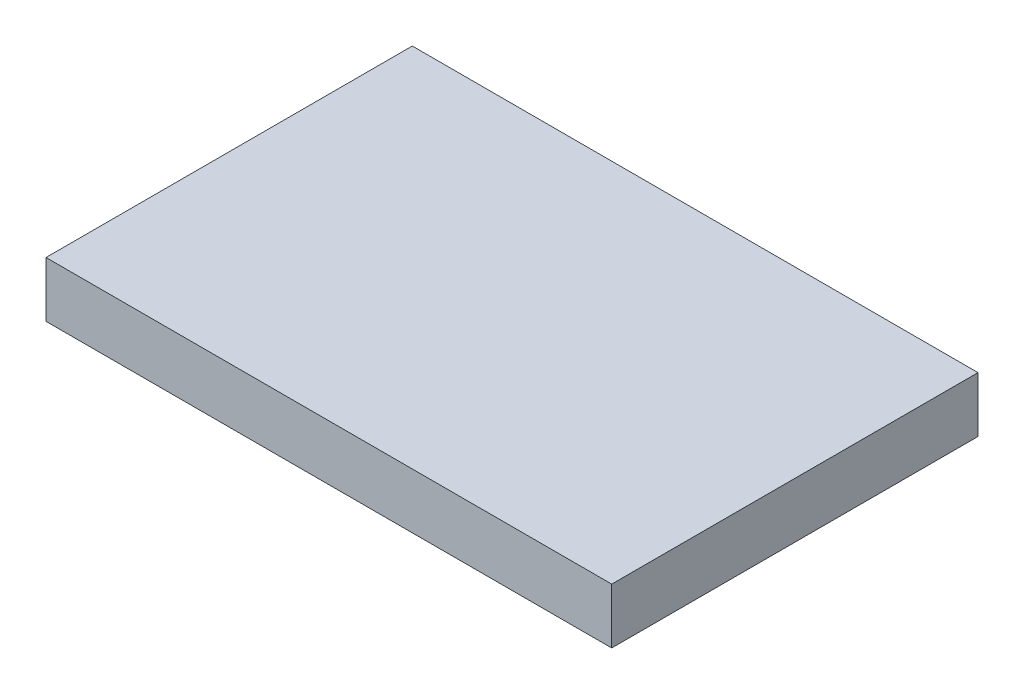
SolidWorks part; units mm, degrees
ref_plane "Front Plane" through (0, 0, 0) normal (0, 0, 1) x (1, 0, 0)
ref_plane "Top Plane" through (0, 0, 0) normal (0, 1, 0) x (1, 0, 0)
ref_plane "Right Plane" through (0, 0, 0) normal (1, 0, 0) x (0, 0, -1)
sketch "Sketch1" plane through (0, 0, 0) normal (0, 1, 0) x (1, 0, 0)
  line L0 (-63.6297, -41.1991) -> (63.6297, 41.1991) construction
  line L1 (-63.6297, 41.1991) -> (63.6297, 41.1991)
  line L2 (-63.6297, 41.1991) -> (-63.6297, -41.1991)
  line L3 (-63.6297, -41.1991) -> (63.6297, -41.1991)
  line L4 (63.6297, 41.1991) -> (63.6297, -41.1991)
extrude "Extrude1" add sketch "Sketch1" along normal blind 12.446
